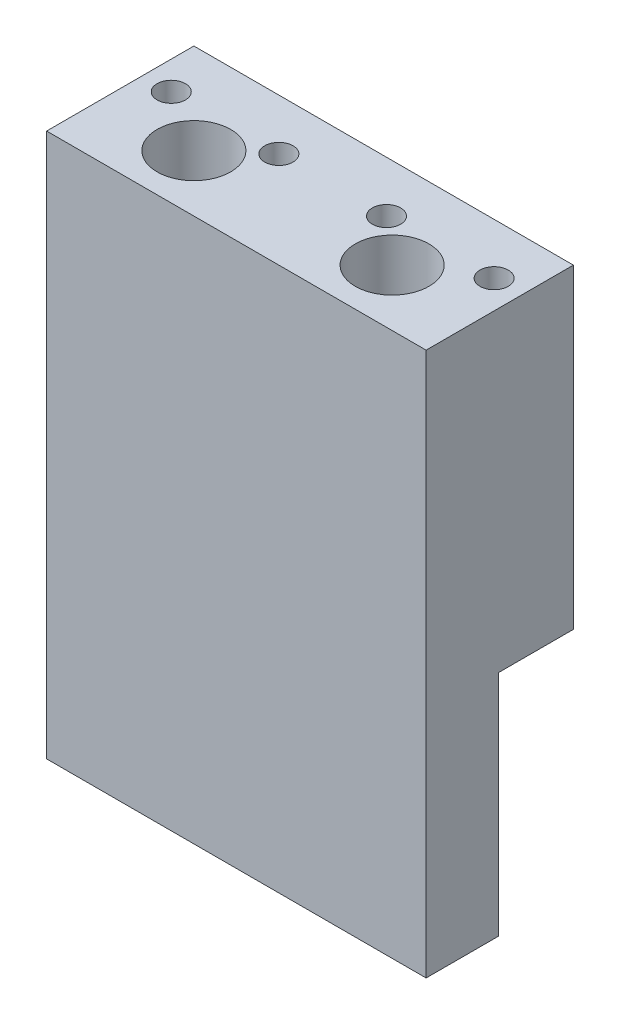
SolidWorks part; units mm, degrees
ref_plane "前视基准面" through (0, 0, 0) normal (0, 0, 1) x (1, 0, 0)
ref_plane "上视基准面" through (0, 0, 0) normal (0, 1, 0) x (1, 0, 0)
ref_plane "右视基准面" through (0, 0, 0) normal (1, 0, 0) x (0, 0, -1)
sketch "草图1" plane through (0, 0, 0) normal (0, 0, 1) x (1, 0, 0)
  line L0 (0, 2) -> (1.5525, 2)
  line L1 (0, 50) -> (33.5, 50)
  line L2 (0, 2) -> (0, 50)
  line L3 (33.5, 2) -> (33.5, 50)
  line L4 (1.5525, 2) -> (1.5525, 0.5)
  line L5 (3.4525, 2) -> (3.4525, 0.5)
  line L6 (5.9525, 2) -> (5.9525, 0.5)
  line L7 (4.0525, 2) -> (4.0525, 0.5)
  line L8 (6.5525, 2) -> (6.5525, 0.5)
  line L9 (7.9525, 2) -> (7.9525, 0.5)
  line L10 (8.5525, 2) -> (8.5525, 0.5)
  line L11 (10.4525, 2) -> (10.4525, 0.5)
  line L12 (11.0525, 2) -> (11.0525, 0.5)
  line L13 (12.9525, 2) -> (12.9525, 0.5)
  line L14 (2.0525, 0) -> (2.9525, 0)
  line L15 (4.5525, 0) -> (5.4525, 0)
  line L16 (7.0525, 0) -> (7.4525, 0)
  line L17 (9.0525, 0) -> (9.9525, 0)
  line L18 (11.5525, 0) -> (12.4525, 0)
  line L19 (2.0525, 0) -> (1.5525, 0.5)
  line L20 (2.9525, 0) -> (3.4525, 0.5)
  line L21 (4.5525, 0) -> (4.0525, 0.5)
  line L22 (5.4525, 0) -> (5.9525, 0.5)
  line L23 (7.0525, 0) -> (6.5525, 0.5)
  line L24 (7.4525, 0) -> (7.9525, 0.5)
  line L25 (9.0525, 0) -> (8.5525, 0.5)
  line L26 (9.9525, 0) -> (10.4525, 0.5)
  line L27 (12.4525, 0) -> (12.9525, 0.5)
  line L28 (11.5525, 0) -> (11.0525, 0.5)
  line L29 (30.5525, 0) -> (30.0525, 0.5)
  line L30 (31.4525, 0) -> (31.9525, 0.5)
  line L31 (28.9525, 0) -> (29.4525, 0.5)
  line L32 (28.0525, 0) -> (27.5525, 0.5)
  line L33 (26.4525, 0) -> (26.9525, 0.5)
  line L34 (26.0525, 0) -> (25.5525, 0.5)
  line L35 (24.4525, 0) -> (24.9525, 0.5)
  line L36 (23.5525, 0) -> (23.0525, 0.5)
  line L37 (21.9525, 0) -> (22.4525, 0.5)
  line L38 (21.0525, 0) -> (20.5525, 0.5)
  line L39 (30.5525, 0) -> (31.4525, 0)
  line L40 (28.0525, 0) -> (28.9525, 0)
  line L41 (26.0525, 0) -> (26.4525, 0)
  line L42 (23.5525, 0) -> (24.4525, 0)
  line L43 (21.0525, 0) -> (21.9525, 0)
  line L44 (31.9525, 2) -> (31.9525, 0.5)
  line L45 (30.0525, 2) -> (30.0525, 0.5)
  line L46 (29.4525, 2) -> (29.4525, 0.5)
  line L47 (27.5525, 2) -> (27.5525, 0.5)
  line L48 (26.9525, 2) -> (26.9525, 0.5)
  line L49 (25.5525, 2) -> (25.5525, 0.5)
  line L50 (23.0525, 2) -> (23.0525, 0.5)
  line L51 (24.9525, 2) -> (24.9525, 0.5)
  line L52 (22.4525, 2) -> (22.4525, 0.5)
  line L53 (20.5525, 2) -> (20.5525, 0.5)
  line L54 (3.4525, 2) -> (4.0525, 2)
  line L55 (5.9525, 2) -> (6.5525, 2)
  line L56 (10.4525, 2) -> (11.0525, 2)
  line L57 (12.9525, 2) -> (20.5525, 2)
  line L58 (7.9525, 2) -> (8.5525, 2)
  line L59 (22.4525, 2) -> (23.0525, 2)
  line L60 (24.9525, 2) -> (25.5525, 2)
  line L61 (26.9525, 2) -> (27.5525, 2)
  line L62 (29.4525, 2) -> (30.0525, 2)
  line L63 (31.9525, 2) -> (33.5, 2)
extrude "凸台-拉伸1" add sketch "草图1" along normal blind 13
sketch "草图2" plane through (33.5, 0, 0) normal (1, 0, 0) x (0, 0, -1)
  line L0 (-6.6, 0) -> (-6.6, 22.15)
  line L1 (-13, 2) -> (-13, 50)
  line L2 (-13, 2) -> (-8.9, 2)
  line L3 (-13, 50) -> (0, 50)
  line L4 (0, 22.15) -> (0, 50)
  line L5 (-6.6, 22.15) -> (0, 22.15)
  line L6 (-8.9, 0) -> (-8.9, 2)
  line L7 (-8.9, 0) -> (-6.6, 0)
extrude "切除-拉伸1" cut sketch "草图2" against normal through all flip side to cut
sketch "草图3" plane through (0, 50, 0) normal (0, 1, 0) x (1, 0, 0)
  circle A0 centre (2.5025, -4.5) radius 0.75
  circle A1 centre (12.0025, -4.5) radius 0.75
  circle A2 centre (21.5025, -4.5) radius 0.75
  circle A3 centre (31.0025, -4.5) radius 0.75
extrude "切除-拉伸2" cut sketch "草图3" against normal through all
sketch "草图4" plane through (0, 50, 0) normal (0, 1, 0) x (1, 0, 0)
  circle A0 centre (31.0025, -4.5) radius 1.25
  circle A1 centre (21.5025, -4.5) radius 1.25
  circle A2 centre (12.0025, -4.5) radius 1.25
  circle A3 centre (2.5025, -4.5) radius 1.25
extrude "切除-拉伸3" cut sketch "草图4" against normal blind 13
sketch "草图5" plane through (0, 50, 0) normal (0, 1, 0) x (1, 0, 0)
  circle A0 centre (31.0025, -4.5) radius 1.25
  circle A1 centre (21.5025, -4.5) radius 1.25
  circle A2 centre (12.0025, -4.5) radius 1.25
  circle A3 centre (2.5025, -4.5) radius 1.25
  circle A4 centre (8, -8) radius 3.25
  circle A5 centre (25.5, -8) radius 3.25
extrude "切除-拉伸4" cut sketch "草图5" against normal blind 10
